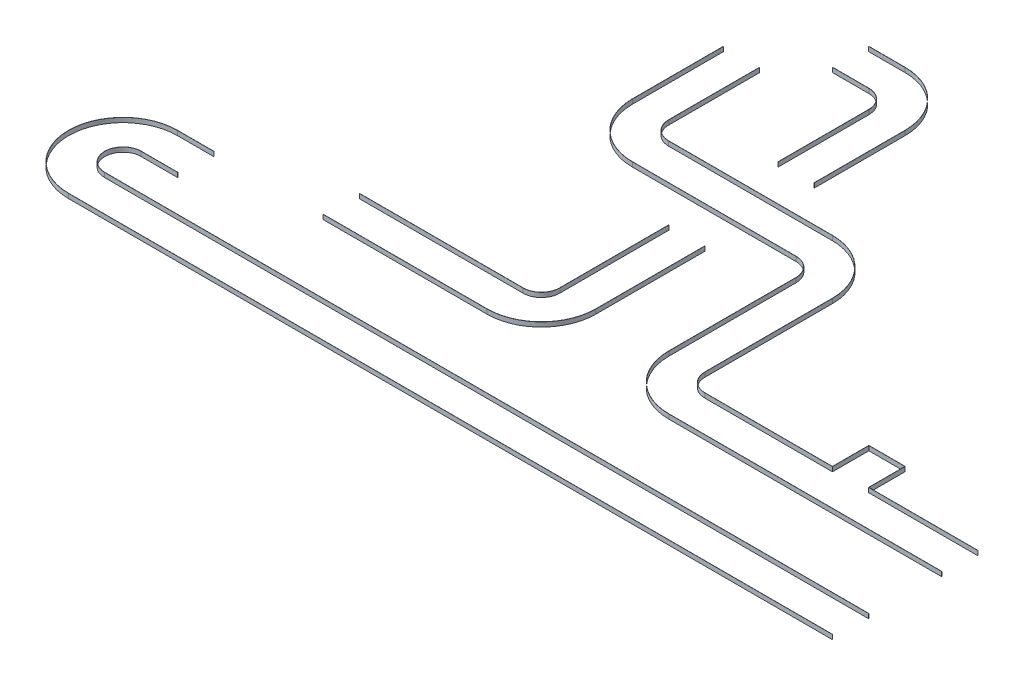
SolidWorks part; units mm, degrees
ref_plane "Front Plane" through (0, 0, 0) normal (0, 0, 1) x (1, 0, 0)
ref_plane "Top Plane" through (0, 0, 0) normal (0, 1, 0) x (1, 0, 0)
ref_plane "Right Plane" through (0, 0, 0) normal (1, 0, 0) x (0, 0, -1)
sketch "Sketch1" plane through (0, 0, 0) normal (0, 1, 0) x (1, 0, 0)
  line L0 (0, 0) -> (-12801.6, 0)
  line L1 (0, 0) -> (0, 609.6)
  line L2 (0, 609.6) -> (-12801.6, 609.6)
  line L3 (-12801.6, 1828.8) -> (-12192, 1828.8)
  line L4 (0, 1828.8) -> (0, 2438.4)
  line L5 (-12192, 1828.8) -> (-12192, 2438.4)
  line L6 (-12192, 2438.4) -> (-7620, 2438.4)
  line L7 (-12801.6, 1219.2) -> (-12192, 1219.2)
  line L8 (-12192, 1219.2) -> (-10363.2, 1219.2)
  line L9 (0, 1828.8) -> (-4572, 1828.8)
  line L10 (-10363.2, 1828.8) -> (-10363.2, 1219.2)
  line L11 (-10363.2, 1828.8) -> (-7620, 1828.8)
  line L12 (0, 2438.4) -> (-1828.8, 2438.4)
  line L13 (-5486.4, 2743.2) -> (-5486.4, 4876.8)
  line L14 (-4876.8, 2743.2) -> (-4876.8, 4876.8)
  line L15 (-5791.2, 5791.2) -> (-8534.4, 5791.2)
  line L16 (-5791.2, 5181.6) -> (-8534.4, 5181.6)
  line L17 (-8839.2, 6096) -> (-8839.2, 7620)
  line L18 (-9448.8, 6096) -> (-9448.8, 7620)
  line L19 (-9448.8, 7620) -> (-9448.8, 8839.2)
  line L20 (-9448.8, 8839.2) -> (-8229.6, 8839.2)
  line L21 (-8839.2, 7620) -> (-8229.6, 7620)
  line L22 (-8229.6, 7620) -> (-8229.6, 8229.6)
  line L23 (-8229.6, 8839.2) -> (-7620, 8839.2)
  line L24 (-8229.6, 8229.6) -> (-7620, 8229.6)
  line L25 (-7315.2, 7924.8) -> (-7315.2, 6400.8)
  line L26 (-6705.6, 7924.8) -> (-6705.6, 6400.8)
  line L27 (-7315.2, 6400.8) -> (-6705.6, 6400.8)
  line L28 (-7315.2, 4572) -> (-7315.2, 2743.2)
  line L29 (-7315.2, 4572) -> (-6705.6, 4572)
  line L30 (-6705.6, 4572) -> (-6705.6, 2743.2)
  line L31 (-2438.4, 2438.4) -> (-4572, 2438.4)
  line L33 (-2438.4, 2438.4) -> (-2438.4, 3048)
  line L34 (-2438.4, 3048) -> (-1828.8, 3048)
  line L35 (-1828.8, 2438.4) -> (-1828.8, 3048)
  arc A0 (-12801.6, 0) -> (-12801.6, 1828.8) centre (-12801.6, 914.4) cw
  arc A1 (-12801.6, 609.6) -> (-12801.6, 1219.2) centre (-12801.6, 914.4) cw
  arc A2 (-4572, 1828.8) -> (-5486.4, 2743.2) centre (-4572, 2743.2) cw
  arc A3 (-4572, 2438.4) -> (-4876.8, 2743.2) centre (-4572, 2743.2) cw
  arc A4 (-4876.8, 4876.8) -> (-5791.2, 5791.2) centre (-5791.2, 4876.8) ccw
  arc A5 (-5486.4, 4876.8) -> (-5791.2, 5181.6) centre (-5791.2, 4876.8) ccw
  arc A6 (-8534.4, 5181.6) -> (-9448.8, 6096) centre (-8534.4, 6096) cw
  arc A7 (-8534.4, 5791.2) -> (-8839.2, 6096) centre (-8534.4, 6096) cw
  arc A8 (-7620, 8839.2) -> (-6705.6, 7924.8) centre (-7620, 7924.8) cw
  arc A9 (-7620, 8229.6) -> (-7315.2, 7924.8) centre (-7620, 7924.8) cw
  arc A10 (-7620, 2438.4) -> (-7315.2, 2743.2) centre (-7620, 2743.2) ccw
  arc A11 (-7620, 1828.8) -> (-6705.6, 2743.2) centre (-7620, 2743.2) ccw
  dimension "D8" = 914.4
  dimension "D9" = 609.6
  dimension "D10" = 304.8
  dimension "D16" = 914.4
  dimension "D17" = 304.8
  dimension "D20" = 914.4
  dimension "D21" = 304.8
  dimension "D25" = 914.4
  dimension "D26" = 304.8
  dimension "D35" = 914.4
  dimension "D36" = 304.8
  dimension "D42" = 914.4
  dimension "D1" = 609.6
  dimension "D2" = 12801.6
  dimension "D3" = 12801.6
  dimension "D4" = 609.6
  dimension "D5" = 12801.6
  dimension "D6" = 609.6
  dimension "D7" = 1219.2
  dimension "D11" = 609.6
  dimension "D12" = 12192
  dimension "D13" = 1828.8
  dimension "D14" = 4572
  dimension "D15" = 3048
  dimension "D18" = 2133.6
  dimension "D19" = 2133.6
  dimension "D22" = 2743.2
  dimension "D23" = 609.6
  dimension "D24" = 609.6
  dimension "D27" = 1524
  dimension "D28" = 1524
  dimension "D29" = 1219.2
  dimension "D30" = 1219.2
  dimension "D31" = 609.6
  dimension "D32" = 609.6
  dimension "D33" = 609.6
  dimension "D34" = 609.6
  dimension "D37" = 609.6
  dimension "D38" = 1524
  dimension "D39" = 609.6
  dimension "D40" = 1828.8
  dimension "D41" = 1828.8
  dimension "D43" = 609.6
  dimension "D44" = 609.6
  dimension "D45" = 609.6
  dimension "D46" = 1828.8
extrude "Boss-Extrude1" add sketch "Sketch1" along normal blind 76.2
sketch "Sketch3" plane through (0, 76.2, 0) normal (0, 1, 0) x (1, 0, 0)
  line L1 (-12192, 2438.4) -> (-10363.2, 2438.4)
  line L2 (-12192, 2438.4) -> (-12192, 1219.2)
  line L3 (-12192, 1219.2) -> (-10363.2, 1219.2)
  line L4 (-10363.2, 2438.4) -> (-10363.2, 1219.2)
  line L5 (-9448.8, 8839.2) -> (-8229.6, 8839.2)
  line L6 (-9448.8, 8839.2) -> (-9448.8, 7620)
  line L7 (-9448.8, 7620) -> (-8229.6, 7620)
  line L8 (-8229.6, 8839.2) -> (-8229.6, 7620)
extrude "Cut-Extrude1" cut sketch "Sketch3" against normal blind 76.2
shell "Shell1" thickness 2.54
shell "Shell2" thickness 2.54
shell "Shell3" thickness 2.54
shell "Shell4" thickness 2.54
sketch "Sketch4" plane through (0, 76.2, 0) normal (0, 1, 0) x (1, 0, 0)
  line L0 (0, 0) -> (0, 609.6) construction
  line L1 (-2.54, 607.06) -> (0, 607.06)
  line L2 (-2.54, 607.06) -> (-2.54, 2.54)
  line L3 (-2.54, 2.54) -> (0, 2.54)
  line L4 (0, 607.06) -> (0, 2.54)
  line L5 (0, 1828.8) -> (0, 2438.4) construction
  line L6 (-2.54, 2435.86) -> (0, 2435.86)
  line L7 (-2.54, 2435.86) -> (-2.54, 1831.34)
  line L8 (-2.54, 1831.34) -> (0, 1831.34)
  line L9 (0, 2435.86) -> (0, 1831.34)
  line L11 (-12192, 1828.8) -> (-12192, 1219.2) construction
  line L12 (-12194.54, 1826.26) -> (-12192, 1826.26)
  line L13 (-12194.54, 1826.26) -> (-12194.54, 1221.74)
  line L14 (-12194.54, 1221.74) -> (-12192, 1221.74)
  line L15 (-12192, 1826.26) -> (-12192, 1221.74)
  line L16 (-10363.2, 1828.8) -> (-10363.2, 2438.4) construction
  line L17 (-10360.66, 2435.86) -> (-10363.2, 2435.86)
  line L18 (-10360.66, 2435.86) -> (-10360.66, 1831.34)
  line L19 (-10360.66, 1831.34) -> (-10363.2, 1831.34)
  line L20 (-10363.2, 2435.86) -> (-10363.2, 1831.34)
  line L21 (-6705.6, 4572) -> (-7315.2, 4572) construction
  line L22 (-7312.66, 4569.46) -> (-6708.14, 4569.46)
  line L23 (-7312.66, 4569.46) -> (-7312.66, 4572)
  line L24 (-7312.66, 4572) -> (-6708.14, 4572)
  line L25 (-6708.14, 4569.46) -> (-6708.14, 4572)
  line L26 (-9448.8, 7620) -> (-8839.2, 7620) construction
  line L27 (-9446.26, 7617.46) -> (-8841.74, 7617.46)
  line L28 (-9446.26, 7617.46) -> (-9446.26, 7620)
  line L29 (-9446.26, 7620) -> (-8841.74, 7620)
  line L30 (-8841.74, 7617.46) -> (-8841.74, 7620)
  line L31 (-7315.2, 6400.8) -> (-6705.6, 6400.8) construction
  line L32 (-7312.66, 6403.34) -> (-6708.14, 6403.34)
  line L33 (-7312.66, 6403.34) -> (-7312.66, 6400.8)
  line L34 (-7312.66, 6400.8) -> (-6708.14, 6400.8)
  line L35 (-6708.14, 6403.34) -> (-6708.14, 6400.8)
  line L36 (-8229.6, 8229.6) -> (-8229.6, 8839.2) construction
  line L37 (-8227.06, 8836.66) -> (-8229.6, 8836.66)
  line L38 (-8227.06, 8836.66) -> (-8227.06, 8232.14)
  line L39 (-8227.06, 8232.14) -> (-8229.6, 8232.14)
  line L40 (-8229.6, 8836.66) -> (-8229.6, 8232.14)
extrude "Cut-Extrude3" cut sketch "Sketch4" against normal blind 76.2
